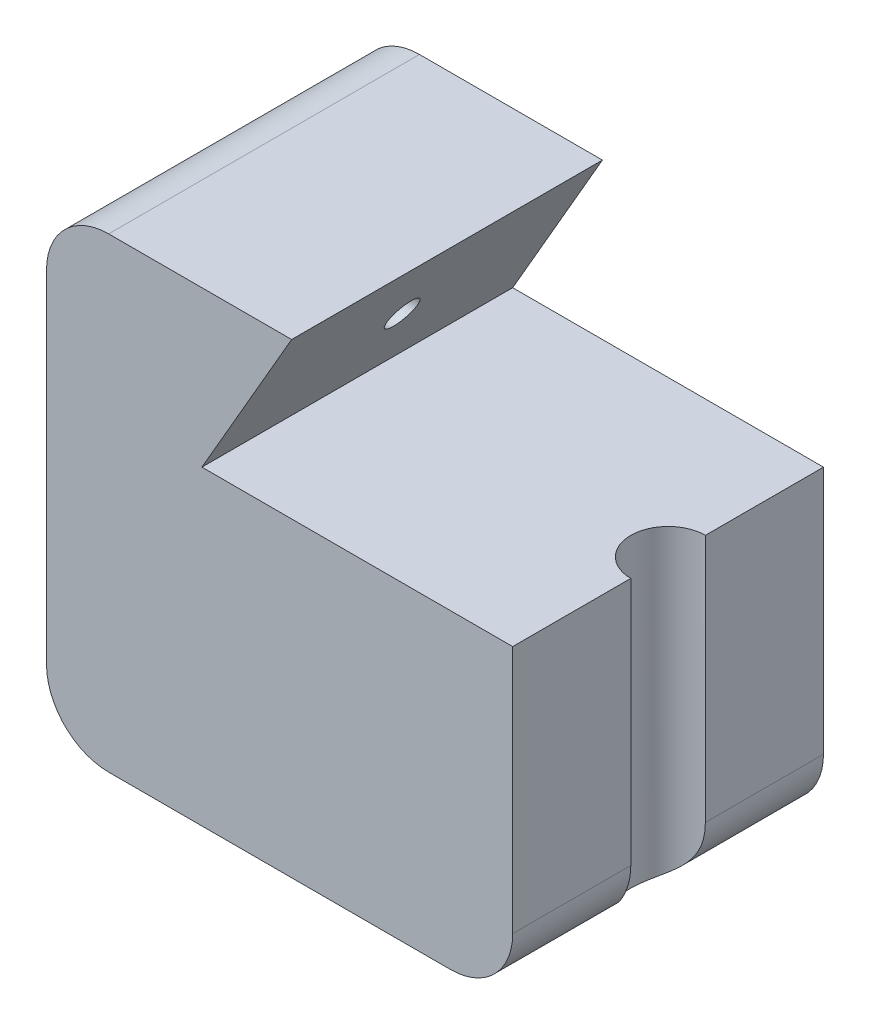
SolidWorks part; units mm, degrees
ref_plane "Front Plane" through (0, 0, 0) normal (0, 0, 1) x (1, 0, 0)
ref_plane "Top Plane" through (0, 0, 0) normal (0, 1, 0) x (1, 0, 0)
ref_plane "Right Plane" through (0, 0, 0) normal (1, 0, 0) x (0, 0, -1)
sketch "Sketch1" plane through (0, 0, 0) normal (0, 0, 1) x (1, 0, 0)
  line L0 (0, 10) -> (0, 65)
  line L1 (10, 75) -> (39.4338, 75)
  line L2 (39.4338, 75) -> (25, 50)
  line L3 (25, 50) -> (75, 50)
  line L4 (75, 50) -> (75, 10)
  line L5 (65, 0) -> (10, 0)
  line L6 (75, -958.2633) -> (75, 49041.7367) construction
  arc A0 (0, 10) -> (10, 0) centre (10, 10) ccw
  arc A1 (65, 0) -> (75, 10) centre (65, 10) ccw
  arc A2 (0, 65) -> (10, 75) centre (10, 65) cw
  point P11 (0, 0)
extrude "Boss-Extrude1" add sketch "Sketch1" along normal blind 50
sketch "Sketch2" plane through (0, 50, 0) normal (0, 1, 0) x (1, 0, 0)
  line L1 (75, -50) -> (75, 0) construction
  circle A0 centre (75, -25) radius 6
  point P8 (75, -25)
extrude "Cut-Extrude1" cut sketch "Sketch2" against normal up to surface (50 mm away)
sketch "Sketch3" plane through (0, 0, 0) normal (-1, 0, 0) x (0, 0, 1)
  line L0 (25, -900) -> (25, 49100) construction
  line L1 (50, 75) -> (0, 75) construction
  circle A0 centre (25, 62.5) radius 2.5
  point P5 (25, 75)
extrude "Cut-Extrude2" cut sketch "Sketch3" against normal up to surface (75 mm away)
equation "\"ShaftDiameter\"= 12mm"
equation "\"PendulumDiameter\"=12mm"
equation "\"PendulumLength\"= 140mm"
equation "\"EncoderOuterDiameter\"=1.5"
equation "\"EncoderShaftDiameter\"= 6mm"
equation "\"EncoderShaftLength\"=15mm+.5in+3mm"
equation "\"D1@Sketch2\"=\"PendulumDiameter\""
equation "\"PendulumHolderangle\"=60"
equation "\"D1@Sketch1\"=\"PendulumHolderangle\""
equation "\"PendulumholderBottomHeight\"= 75"
equation "\"D3@Sketch1\"=\"PendulumholderBottomHeight\""
equation "\"PendulumholderBottomWidth\"= 75"
equation "\"D4@Sketch1\"=\"PendulumholderBottomWidth\""
equation "\"PendulumholderHeight\"=25"
equation "\"D2@Sketch1\"=\"PendulumholderHeight\""
equation "\"BearingOutsideDiameter\"=21mm"
equation "\"PendulumHolderWidth\"= 100mm"
equation "\"D5@Sketch1\"= \"PendulumHolderWidth\" / 2"
equation "\"ScrewHole\"= 5mm"
equation "\"ShaftHeightFromTSlot\"= 100mm"
equation "\"BearingThickness\"= 5mm"
equation "\"SlipRingOuterDiameter\"=56mm"
equation "\"SlipringBigThickness\"=25mm"
equation "\"SlipringSmallThickness\"=8.5mm"
equation "\"Tol\"=2mm"
equation "\"D1@Sketch3\"=\"ScrewHole\""
